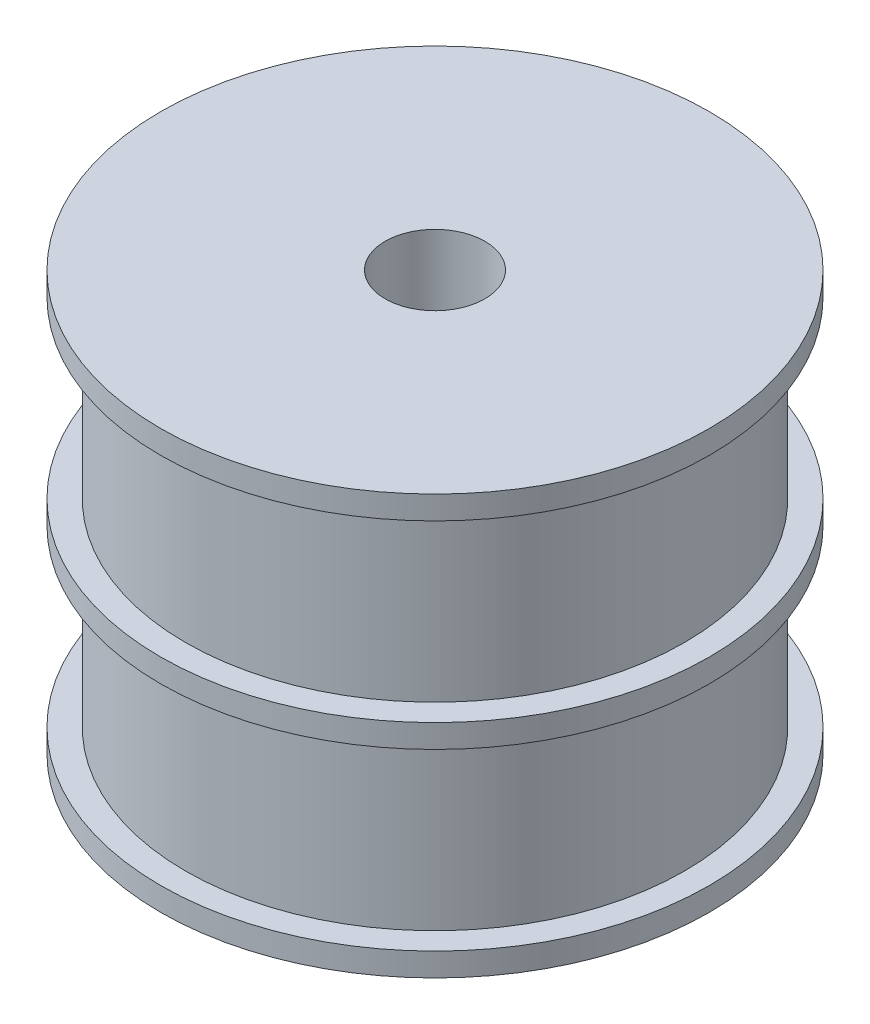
SolidWorks part; units mm, degrees
ref_plane "Front Plane" through (0, 0, 0) normal (0, 0, 1) x (1, 0, 0)
ref_plane "Top Plane" through (0, 0, 0) normal (0, 1, 0) x (1, 0, 0)
ref_plane "Right Plane" through (0, 0, 0) normal (1, 0, 0) x (0, 0, -1)
sketch "Sketch1" plane through (0, 0, 0) normal (0, 0, 1) x (1, 0, 0)
  line L0 (0, 0) -> (0, 8.4) construction
  line L1 (0, 0) -> (1, 0) construction
  line L2 (0, 8.4) -> (1, 8.4) construction
  line L3 (1, 8.4) -> (1, 0)
  line L4 (1, 8.4) -> (5.5, 8.4)
  line L5 (5.5, 8.4) -> (5.5, 7.9333)
  line L6 (5.5, 7.9333) -> (5, 7.9333)
  line L7 (5, 7.9333) -> (5, 4.4333)
  line L8 (5, 4.4333) -> (5.5, 4.4333)
  line L9 (5.5, 4.4333) -> (5.5, 3.9667)
  line L10 (5.5, 3.9667) -> (5, 3.9667)
  line L11 (5, 3.9667) -> (5, 0.4667)
  line L12 (5, 0.4667) -> (5.5, 0.4667)
  line L13 (5.5, 0.4667) -> (5.5, 0)
  line L14 (5.5, 0) -> (1, 0)
  dimension "D1" = 8.4
  dimension "D2" = 1
  dimension "D3" = 5.5
  dimension "D4" = 10
  dimension "D5" = 3.5
revolve "Revolve1" add sketch "Sketch1" angle 360 about L0
